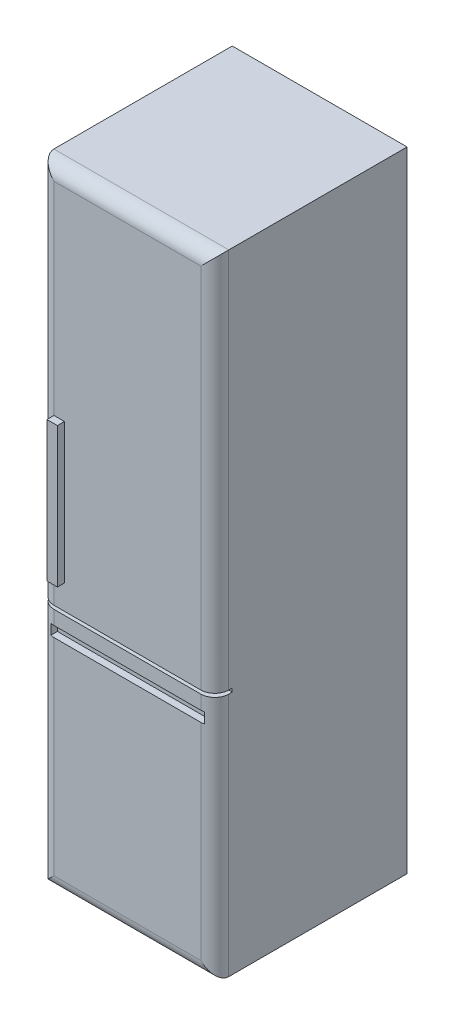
SolidWorks part; units mm, degrees
ref_plane "Plan de face" through (0, 0, 0) normal (0, 0, 1) x (1, 0, 0)
ref_plane "Plan de dessus" through (0, 0, 0) normal (0, 1, 0) x (1, 0, 0)
ref_plane "Plan de droite" through (0, 0, 0) normal (1, 0, 0) x (0, 0, -1)
sketch "Esquisse1" plane through (0, 0, 0) normal (0, 1, 0) x (1, 0, 0)
  line L1 (0, 0) -> (500, 0)
  line L2 (0, 0) -> (0, -550)
  line L3 (0, -550) -> (500, -550)
  line L4 (500, 0) -> (500, -550)
  dimension "D1" = 500
  dimension "D2" = 550
extrude "Boss.-Extru.1" add sketch "Esquisse1" along normal blind 1800
sketch "Esquisse2" plane through (0, 0, 550) normal (0, 0, 1) x (1, 0, 0)
  line L0 (0, 0) -> (500, 0) construction
  line L1 (0, 710) -> (500, 710)
  line L2 (0, 710) -> (0, 700)
  line L3 (0, 700) -> (500, 700)
  line L4 (500, 710) -> (500, 700)
  line L5 (500, 1800) -> (500, 0) construction
  line L6 (0, 1800) -> (0, 0) construction
  dimension "D1" = 10
  dimension "D2" = 700
extrude "Enlèv. mat.-Extru.1" cut sketch "Esquisse2" against normal blind 50
sketch "Esquisse3" plane through (0, 0, 550) normal (0, 0, 1) x (1, 0, 0)
  line L0 (0, 1800) -> (0, 710) construction
  line L1 (40, 1180) -> (70, 1180)
  line L2 (40, 1180) -> (40, 780)
  line L3 (40, 780) -> (70, 780)
  line L4 (70, 1180) -> (70, 780)
  line L5 (500, 710) -> (0, 710) construction
  dimension "D1" = 30
  dimension "D2" = 40
  dimension "D3" = 70
  dimension "D4" = 400
extrude "Boss.-Extru.2" add sketch "Esquisse3" along normal blind 20
sketch "Esquisse4" plane through (0, 0, 550) normal (0, 0, 1) x (1, 0, 0)
  line L0 (0, 700) -> (0, 0) construction
  line L1 (30, 660) -> (470, 660)
  line L2 (30, 660) -> (30, 630)
  line L3 (30, 630) -> (470, 630)
  line L4 (470, 660) -> (470, 630)
  line L5 (500, 700) -> (500, 0) construction
  line L6 (0, 700) -> (500, 700) construction
  dimension "D1" = 30
  dimension "D2" = 30
  dimension "D3" = 30
  dimension "D4" = 40
extrude "Enlèv. mat.-Extru.2" cut sketch "Esquisse4" against normal blind 20
fillet "Congé1" radius 40 6 edges at (250, 0, 550) (500, 350, 550) (0, 350, 550) (500, 1255, 550) (250, 1800, 550) (0, 1255, 550)
